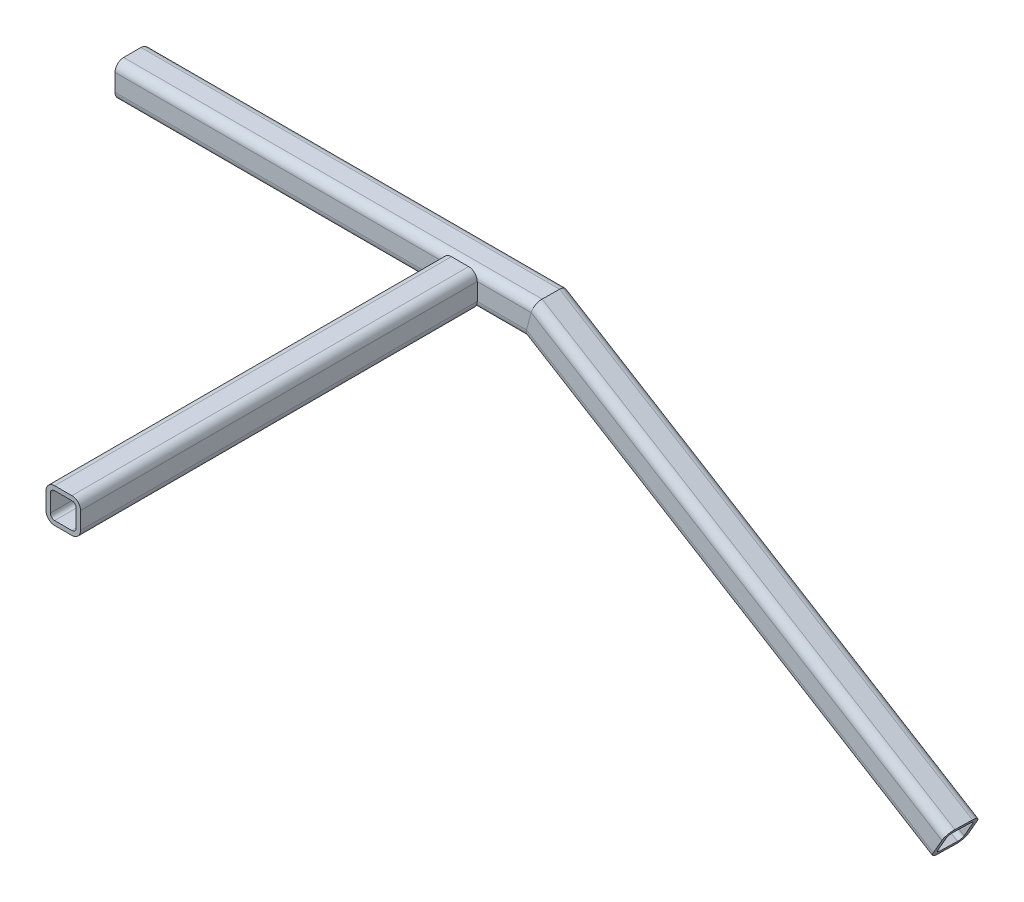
SolidWorks part; units mm, degrees
ref_plane "Front Plane" through (0, 0, 0) normal (0, 0, 1) x (1, 0, 0)
ref_plane "Top Plane" through (0, 0, 0) normal (0, 1, 0) x (1, 0, 0)
ref_plane "Right Plane" through (0, 0, 0) normal (1, 0, 0) x (0, 0, -1)
sketch3d "3DSketch2"
  line L0 (0, 0, 0) -> (609.6, 0, 0)
  line L1 (609.6, 0, 0) -> (1225.5173, -355.3323, 13.7943)
  line L2 (508, 0, 0) -> (508, 0, 609.6)
  dimension "D1" = 609.6
  dimension "D2" = 711.2
  dimension "D3" = 30
  dimension "D4" = 609.6
  dimension "D5" = 101.6
other "Square tube 2 X 2 X 0.25(1)"
ref_plane "Plane1" through (0, 0, 0) normal (1, 0, 0) x (0, 0, -1)
sketch "Sketch12" plane through (0, 0, 0) normal (1, 0, 0) x (0, 0, -1)
  line L0 (-12.7, -19.05) -> (12.7, -19.05)
  line L1 (-19.05, -12.7) -> (-19.05, 12.7)
  line L2 (12.7, 19.05) -> (-12.7, 19.05)
  line L3 (19.05, 12.7) -> (19.05, -12.7)
  line L4 (-12.7, -25.4) -> (12.7, -25.4)
  line L5 (-25.4, -12.7) -> (-25.4, 12.7)
  line L6 (12.7, 25.4) -> (-12.7, 25.4)
  line L7 (25.4, 12.7) -> (25.4, -12.7)
  line L8 (0, 0) -> (19.05, 0) construction
  line L9 (0, 0) -> (0, 19.05) construction
  arc A0 (25.4, 12.7) -> (12.7, 25.4) centre (12.7, 12.7) ccw
  arc A1 (12.7, -25.4) -> (25.4, -12.7) centre (12.7, -12.7) ccw
  arc A2 (-25.4, -12.7) -> (-12.7, -25.4) centre (-12.7, -12.7) ccw
  arc A3 (-12.7, 25.4) -> (-25.4, 12.7) centre (-12.7, 12.7) ccw
  arc A4 (-12.7, 19.05) -> (-19.05, 12.7) centre (-12.7, 12.7) ccw
  arc A5 (19.05, 12.7) -> (12.7, 19.05) centre (12.7, 12.7) ccw
  arc A6 (12.7, -19.05) -> (19.05, -12.7) centre (12.7, -12.7) ccw
  arc A7 (-19.05, -12.7) -> (-12.7, -19.05) centre (-12.7, -12.7) ccw
  point P3 (0, 25.4)
  point P4 (25.4, 0)
  point P5 (0, -25.4)
  point P6 (-25.4, 0)
  point P7 (-25.4, 25.4)
  point P8 (-25.4, -25.4)
  point P33 (0, 0)
  point P35 (25.4, -25.4)
  point P36 (25.4, 25.4)
  point P37 (0, 0)
  dimension "D1" = 12.7
  dimension "Thickness" = 6.35
  dimension "V_leg" = 50.8
